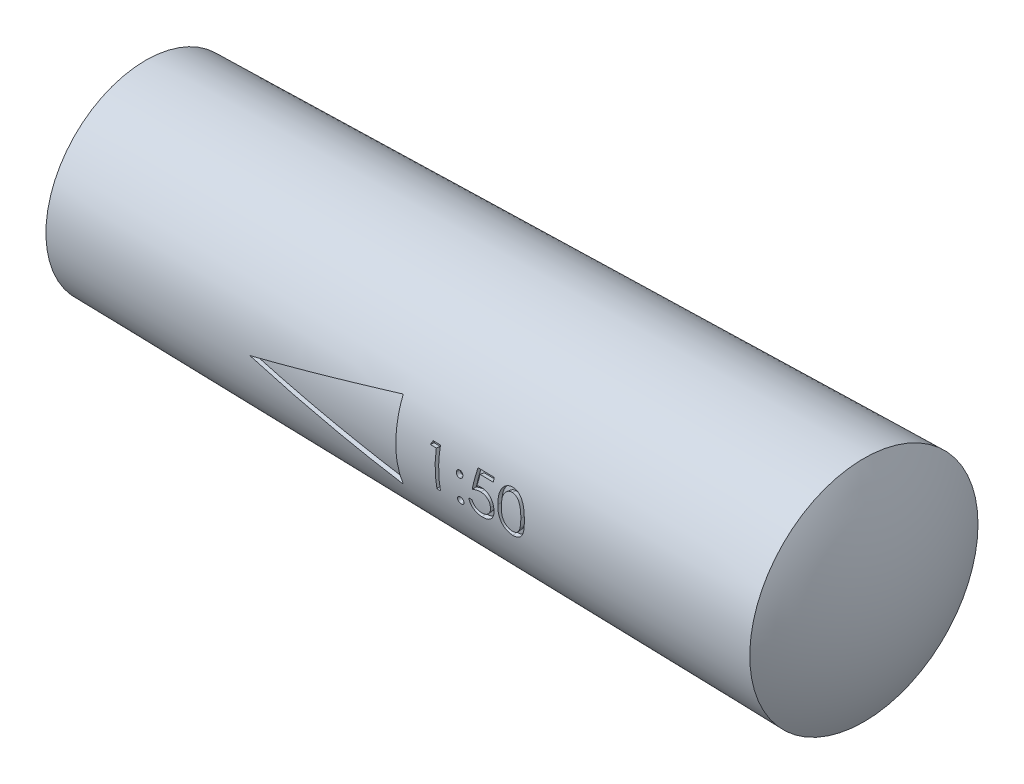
SolidWorks part; units mm, degrees
ref_plane "Front Plane" through (0, 0, 0) normal (0, 0, 1) x (1, 0, 0)
ref_plane "Top Plane" through (0, 0, 0) normal (0, 1, 0) x (1, 0, 0)
ref_plane "Right Plane" through (0, 0, 0) normal (1, 0, 0) x (0, 0, -1)
sketch "Sketch1" plane through (0, 0, 0) normal (1, 0, 0) x (0, 0, -1)
  circle A0 centre (0, 0) radius 2.5
  dimension "D1" = 5
extrude "Extrude1" add sketch "Sketch1" along normal mid plane 18
draft "Draft1" type of draft neutral plane draft angle 1.146 faces to draft 1 parameters "D1"=1.146
sketch "Sketch2" plane through (0, 0, 0) normal (0, 0, 1) x (1, 0, 0)
  line L0 (-9, 0) -> (-9, 2.5)
  line L1 (-9, 2.5) -> (-9, -2.5) construction
  line L2 (-9, 0) -> (-9.75, 0)
  line L3 (-9.75, 0) -> (-9.75, -2.68) construction
  line L4 (9, 0) -> (9, 2.86)
  line L5 (9, -2.86) -> (9, 2.86) construction
  line L6 (9, 0) -> (9.75, 0)
  line L7 (9.75, 0) -> (9.75, -2.68) construction
  line L8 (-9, -2.5) -> (9, -2.86) construction
  arc A0 (-9.75, 0) -> (-9, 2.5) centre (-5.2083, 0) cw
  arc A1 (9.75, 0) -> (9, 2.86) centre (3.9219, 0) ccw
  point P14 (0, -2.68)
revolve "Revolve1" add sketch "Sketch2" angle 360 about L2
sketch "Sketch5" plane through (0, 0, 0) normal (0, 0, 1) x (1, 0, 0)
  line L0 (0, 2.68) -> (0, -2.68) construction
  line L1 (9, 2.86) -> (-9, 2.5) construction
  line L2 (-9, -2.5) -> (9, -2.86) construction
ref_plane "Plane2" through (0, 0, 0) normal (-0.02, 0, 0.9998) x (0.9998, 0, 0.02)
sketch "Sketch6" plane through (0, 0, 0) normal (-0.02, 0, 0.9998) x (0.9998, 0, 0.02)
  line L0 (0, 0) -> (0, 1)
  line L1 (0, 2.68) -> (0, -2.68) construction
  line L2 (0, 1) -> (-3.7321, 0)
  line L3 (-3.7321, 0) -> (0, -1)
  line L4 (0, -1) -> (0, 0)
  line L5 (0, -0.5) -> (4, -0.5) construction
  text T0 "1:50" font "Century Gothic" height 1
  dimension "D1" = 2
  dimension "D2" = 30
  dimension "D3" = 4
wrap "Wrap2" sketch "Sketch6" wrap type deboss source sketch "Sketch6" thickness 0.1 parameters "D1"=0.1
equation "\"D2@Sketch2\" = \"D1@Sketch2\""
